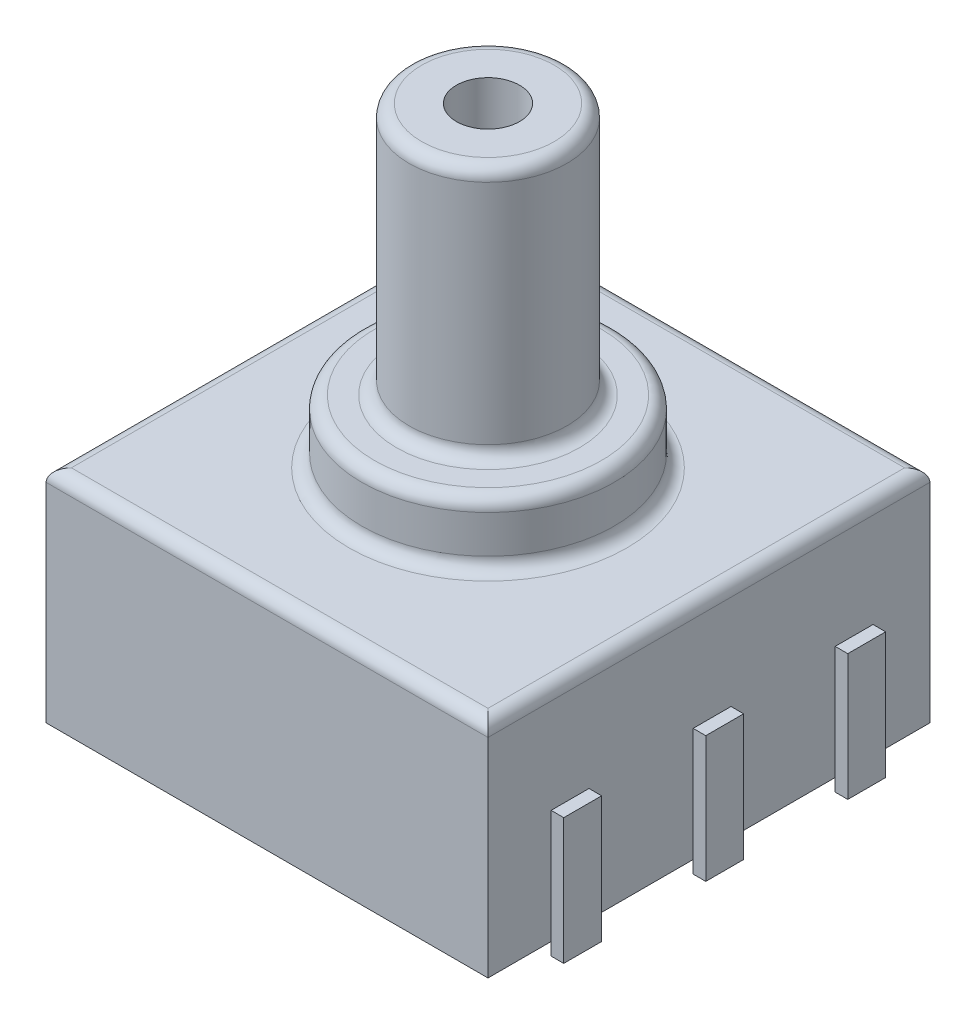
SolidWorks part; units mm, degrees
ref_plane "Face" through (0, 0, 0) normal (0, 0, 1) x (1, 0, 0)
ref_plane "Dessus" through (0, 0, 0) normal (0, 1, 0) x (1, 0, 0)
ref_plane "Droite" through (0, 0, 0) normal (1, 0, 0) x (0, 0, -1)
sketch "Esquisse1" plane through (0, 0, 0) normal (0, 1, 0) x (1, 0, 0)
  line L0 (0, 34.0158) -> (0, -25.8862) construction
  line L1 (-3.5, 3.5) -> (3.5, 3.5)
  line L2 (-3.5, 3.5) -> (-3.5, -3.5)
  line L3 (-3.5, -3.5) -> (3.5, -3.5)
  line L4 (3.5, 3.5) -> (3.5, -3.5)
  line L5 (-26.3141, 0) -> (28.8813, 0) construction
  dimension "D1" = 7
  dimension "D2" = 7
extrude "Extrusion1" add sketch "Esquisse1" along normal blind 3.5
sketch "Esquisse2" plane through (0, 0, 0) normal (1, 0, 0) x (0, 0, -1)
  line L0 (-2, 3.5) -> (-2, 4.5)
  line L1 (-3.5, 3.5) -> (3.5, 3.5) construction
  line L2 (-2, 4.5) -> (-1.25, 4.5)
  line L3 (-1.25, 4.5) -> (-1.25, 8.3)
  line L4 (-1.05, 8.5) -> (-0.5, 8.5)
  line L5 (-0.5, 8.5) -> (-0.5, 3.5)
  line L6 (-0.5, 3.5) -> (-2, 3.5)
  line L7 (0, 7.0289) -> (0, -0.5665) construction
  arc A0 (-1.25, 8.3) -> (-1.05, 8.5) centre (-1.05, 8.3) cw
  dimension "D1" = 0.2
  dimension "D2" = 2.5
  dimension "D3" = 4
  dimension "D4" = 1
  dimension "D5" = 4
  dimension "D6" = 1
revolve "Révolution1" add sketch "Esquisse2" angle 360 about L7
fillet "Congé1" radius 0.2 7 edges at (0, 3.5, -3.5) (3.5, 3.5, 0) (0, 3.5, 3.5) (-3.5, 3.5, 0) (0, 3.5, 2) (0, 4.5, 1.25) (0, 4.5, 2)
sketch "Esquisse3" plane through (3.5, 0, 0) normal (1, 0, 0) x (0, 0, -1)
  line L0 (-3.5, 0) -> (3.5, 0) construction
  line L1 (-2.5, 1.8) -> (-1.9, 1.8)
  line L2 (-2.5, 1.8) -> (-2.5, -0.2)
  line L3 (-2.5, -0.2) -> (-1.9, -0.2)
  line L4 (-1.9, 1.8) -> (-1.9, -0.2)
  line L5 (-3.5, 3.3) -> (-3.5, 0) construction
  dimension "D1" = 0.2
  dimension "D2" = 2
  dimension "D3" = 0.6
  dimension "D4" = 1
extrude "Extrusion2" add sketch "Esquisse3" along normal blind 0.2
mirror "Symétrie1" about plane through (0, 0, 0) normal (1, 0, 0) of "Extrusion2"
pattern_linear "Répétition linéaire1" count 3 spacing 2.25 along (0, 0, -1) of "Symétrie1", "Extrusion2"
